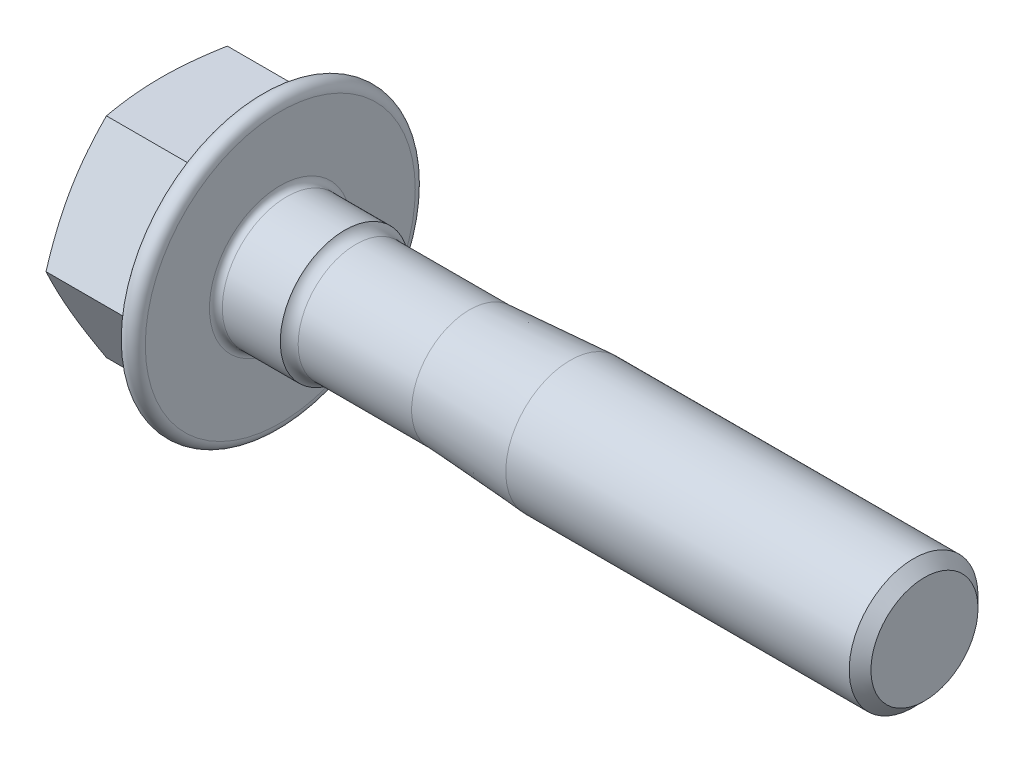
SolidWorks part; units mm, degrees
ref_plane "Front" through (0, 0, 0) normal (0, 0, 1) x (1, 0, 0)
ref_plane "Top" through (0, 0, 0) normal (0, 1, 0) x (1, 0, 0)
ref_plane "Right" through (0, 0, 0) normal (1, 0, 0) x (0, 0, -1)
sketch "Sketch1" plane through (0, 0, 0) normal (1, 0, 0) x (0, 0, -1)
  line L1 (7.5056, 0) -> (3.7528, 6.5)
  line L2 (3.7528, 6.5) -> (-3.7528, 6.5)
  line L3 (-3.7528, 6.5) -> (-7.5056, 0)
  line L4 (-7.5056, 0) -> (-3.7528, -6.5)
  line L5 (-3.7528, -6.5) -> (3.7528, -6.5)
  line L6 (3.7528, -6.5) -> (7.5056, 0)
  circle A0 centre (0, 0) radius 6.5 construction
  dimension "s" = 13
extrude "BaseHead" add sketch "Sketch1" along normal blind 8.1
sketch "Sketch2" plane through (8.1, 0, 0) normal (1, 0, 0) x (0, 0, -1)
  circle A0 centre (0, 0) radius 4
  dimension "d" = 8
extrude "BaseBody" add sketch "Sketch2" along normal blind 40
sketch "Sketch3" plane through (2.9494, 0, 2.8241) normal (0, 1, 0) x (0, 0, -1)
  line L0 (10.3296, 2.9494) -> (10.3296, 1.8919)
  line L2 (10.3296, 1.8919) -> (7.4241, 2.9494)
  line L4 (7.4241, 2.9494) -> (10.3296, 2.9494)
  line L5 (2.8241, 3.9387) -> (2.8241, 2.4525) construction
  dimension "D1" = 20
  dimension "da" = 9.2
revolve "HeadChamfer" cut sketch "Sketch3" angle 360 about L5
sketch "Sketch5" plane through (-0.1752, 0, 7.2752) normal (0, 1, 0) x (0, 0, -1)
  line L0 (7.2752, -8.2752) -> (7.2752, -7.1738) construction
  line L1 (7.2752, -48.2752) -> (7.2752, -8.2752) construction
  line L2 (7.2752, -8.2752) -> (15.6565, -8.2752)
  line L3 (15.8681, -7.0752) -> (7.2752, -3.9476)
  line L4 (7.2752, -3.9476) -> (7.2752, -8.2752)
  line L5 (14.7807, -8.2752) -> (11.0279, -8.2752) construction
  arc A0 (15.6565, -8.2752) -> (15.8681, -7.0752) centre (15.6565, -7.6565) ccw
  dimension "D3" = 20
  dimension "c" = 1.2
  dimension "dc" = 18
revolve "Flange" add sketch "Sketch5" angle 360 about L0
fillet "HeadFillet" radius 0.4 1 edges at (8.1, 0, -4)
fillet "FlangeHexFillet" radius 0.5 6 edges
chamfer "Chamfer1" distance 0.6765 angle 45 1 edges at (48.1, 0, -4)
sketch "Sketch6" plane through (-28.3278, 0, -3) normal (0, 1, 0) x (-1, 0, 0)
  line L0 (-40.4278, 7) -> (-40.4278, 6.594)
  line L1 (-36.4278, 11.3813) -> (-36.4278, -5.3813) construction
  line L2 (-40.4278, 6.594) -> (-48.1778, 6.594)
  line L3 (-48.1778, 6.594) -> (-54.4278, 7)
  line L4 (-54.4278, 7) -> (-40.4278, 7)
  line L5 (-36.8278, 7) -> (-75.7513, 7) construction
  line L6 (-48.9486, 3) -> (-26.9469, 3) construction
  line L7 (-75.7513, 3) -> (-36.8278, 3) construction
  dimension "1d" = 4
  dimension "ls" = 11.75
  dimension "lg" = 18
  dimension "dr" = 7.188
revolve "Cut-Revolve1" cut sketch "Sketch6" angle 360 about L6
fillet "Fillet1" radius 0.812 1 edges at (12.1, 0, -3.594)
equation "\"D1@Chamfer1\" =  ( \"d@Sketch2\" - \"D2@ThreadCosmetic1\" ) / 2"
equation "\"1d@Sketch6\" = \"d@Sketch2\"*0.5"
equation "\"D1@Fillet1\"=(\"d@Sketch2\"-\"dr@Sketch6\")"
